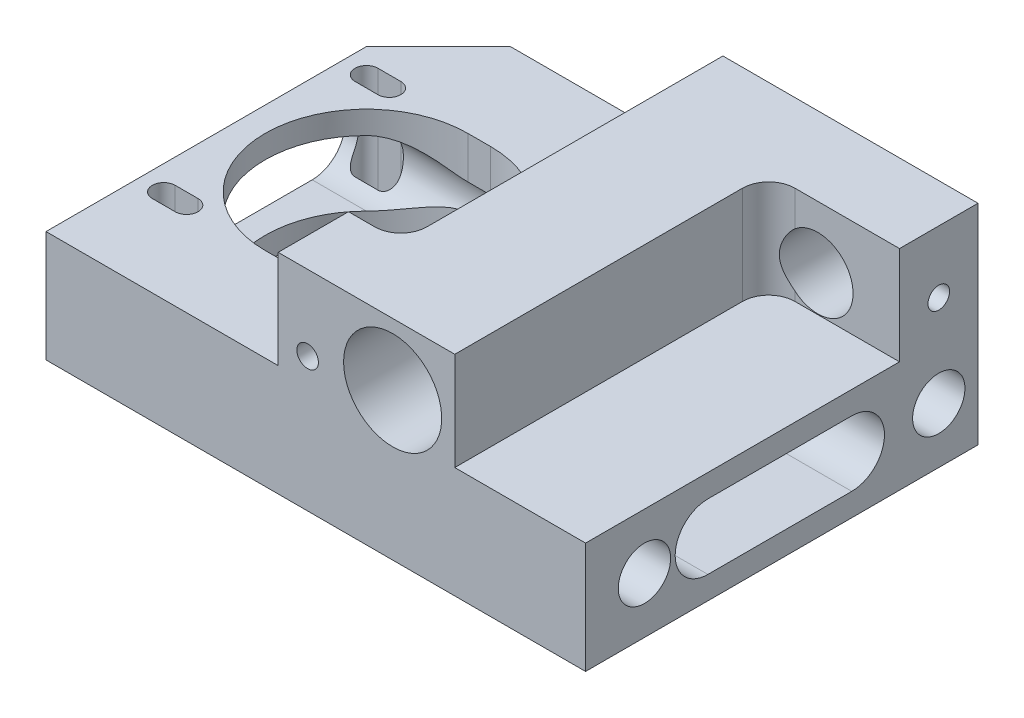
SolidWorks part; units mm, degrees
ref_plane "Plan de face" through (0, 0, 0) normal (0, 0, 1) x (1, 0, 0)
ref_plane "Plan de dessus" through (0, 0, 0) normal (0, 1, 0) x (1, 0, 0)
ref_plane "Plan de droite" through (0, 0, 0) normal (1, 0, 0) x (0, 0, -1)
sketch "Esquisse1" plane through (0, 0, 0) normal (0, 1, 0) x (1, 0, 0)
  line L0 (0, 0) -> (0, 49)
  line L1 (0, 49) -> (11, 60)
  line L2 (11, 60) -> (82.5, 60)
  line L3 (82.5, 60) -> (82.5, 0)
  line L4 (82.5, 0) -> (0, 0)
  line L5 (34.75, 47) -> (38.25, 47)
  line L6 (3.75, 47) -> (7.25, 47)
  line L7 (34.75, 43.5) -> (38.25, 43.5)
  line L8 (3.75, 43.5) -> (7.25, 43.5)
  line L9 (34.75, 16) -> (38.25, 16)
  line L10 (34.75, 12.5) -> (38.25, 12.5)
  line L11 (3.75, 16) -> (7.25, 16)
  line L12 (3.75, 12.5) -> (7.25, 12.5)
  line L13 (19.25, 29.75) -> (22.75, 29.75) construction
  line L14 (19.25, 45.25) -> (22.75, 45.25)
  line L15 (19.25, 14.25) -> (22.75, 14.25)
  arc A0 (7.25, 47) -> (7.25, 43.5) centre (7.25, 45.25) cw
  arc A1 (3.75, 47) -> (3.75, 43.5) centre (3.75, 45.25) ccw
  arc A2 (34.75, 47) -> (34.75, 43.5) centre (34.75, 45.25) ccw
  arc A3 (38.25, 47) -> (38.25, 43.5) centre (38.25, 45.25) cw
  arc A4 (34.75, 16) -> (34.75, 12.5) centre (34.75, 14.25) ccw
  arc A5 (38.25, 16) -> (38.25, 12.5) centre (38.25, 14.25) cw
  arc A6 (3.75, 16) -> (3.75, 12.5) centre (3.75, 14.25) ccw
  arc A7 (7.25, 16) -> (7.25, 12.5) centre (7.25, 14.25) cw
  arc A8 (19.25, 45.25) -> (19.25, 14.25) centre (19.25, 29.75) ccw
  arc A9 (22.75, 14.25) -> (22.75, 45.25) centre (22.75, 29.75) ccw
  point P32 (21, 29.75)
  dimension "D7" = 1.75
  dimension "D11" = 15.5
  dimension "D1" = 82.5
  dimension "D2" = 60
  dimension "D3" = 11
  dimension "D4" = 11
  dimension "D5" = 16.5
  dimension "D6" = 3.75
  dimension "D10" = 3.5
  dimension "D12" = 21
  dimension "D13" = 3.5
  dimension "D14" = 30.25
  dimension "D15" = 31
  dimension "D16" = 31
  dimension "D8" = 2
  dimension "D9" = 2
extrude "Boss.-Extru.1" add sketch "Esquisse1" along normal blind 32
sketch "Esquisse2" plane through (0, 32, 0) normal (0, 1, 0) x (1, 0, 0)
  line L0 (0, 49) -> (11, 60)
  line L1 (11, 60) -> (43.5, 60)
  line L2 (82.5, 60) -> (11, 60) construction
  line L3 (43.5, 60) -> (43.5, 14.75)
  line L4 (39.5, 10.75) -> (35.5, 10.75)
  line L5 (35.5, 10.75) -> (35.5, 0)
  line L6 (0, 0) -> (82.5, 0) construction
  line L7 (35.5, 0) -> (0, 0)
  line L8 (0, 0) -> (0, 49)
  line L9 (66.5, 48) -> (82.5, 48)
  line L10 (82.5, 0) -> (82.5, 60) construction
  line L11 (82.5, 48) -> (82.5, 0)
  line L12 (82.5, 0) -> (62.5, 0)
  line L13 (62.5, 0) -> (62.5, 44)
  arc A0 (43.5, 14.75) -> (39.5, 10.75) centre (39.5, 14.75) cw
  arc A1 (66.5, 48) -> (62.5, 44) centre (66.5, 44) ccw
  dimension "D6" = 4
  dimension "D1" = 10.75
  dimension "D2" = 19
  dimension "D3" = 12
  dimension "D4" = 20
  dimension "D5" = 27
extrude "Enlèv. mat.-Extru.1" cut sketch "Esquisse2" against normal blind 15
sketch "Esquisse3" plane through (0, 0, -60) normal (0, 0, -1) x (-1, 0, 0)
  line L0 (-82.5, 0) -> (-11, 0) construction
  line L1 (-82.5, 32) -> (-82.5, 0) construction
  circle A0 centre (-53, 22.5) radius 7.5
  dimension "D3" = 15
  dimension "D1" = 22.5
  dimension "D2" = 29.5
extrude "Enlèv. mat.-Extru.2" cut sketch "Esquisse3" against normal through all
hole_wizard "Trou taraudé M12x1.251" positions "Esquisse5" profile "Esquisse4" tap size "M12x1.25" standard "ISO"
sketch "Esquisse5" plane through (0, 0, -60) normal (0, 0, -1) x (-1, 0, 0)
  line L0 (-82.5, 0) -> (-11, 0) construction
  line L1 (-82.5, 32) -> (-82.5, 0) construction
  point P0 (-70, 22.5)
  dimension "D1" = 22.5
  dimension "D2" = 12.5
sketch "Esquisse4" plane through (70, 22.5, -60) normal (1, 0, 0) x (0, 1, 0)
  line L0 (0, 0) -> (0, 60)
  line L1 (0, 60) -> (5.4, 60)
  line L2 (5.4, 60) -> (5.4, 0)
  line L5 (5.4, 0) -> (0, 0)
  line L11 (0, -6.35) -> (0, 107.95) construction
  dimension "Diamètre du trou pour taraudage jusqu'au prochain" = 10.8
  dimension "Profondeur du trou pour taraudage jusqu'au prochain" = 60
hole_wizard "Trou taraudé M41" positions "Esquisse7" profile "Esquisse6" tap size "M4" standard "ISO"
sketch "Esquisse7" plane through (0, 0, 0) normal (0, 0, 1) x (1, 0, 0)
  line L0 (82.5, 17) -> (82.5, 0) construction
  line L1 (0, 0) -> (82.5, 0) construction
  point P0 (40, 20.5)
  dimension "D1" = 42.5
  dimension "D2" = 20.5
sketch "Esquisse6" plane through (40, 20.5, 0) normal (1, 0, 0) x (0, -1, 0)
  line L0 (0, 0) -> (0, 60)
  line L1 (0, 60) -> (1.65, 60)
  line L2 (1.65, 60) -> (1.65, 0)
  line L5 (1.65, 0) -> (0, 0)
  line L11 (0, -6.35) -> (0, 107.95) construction
  dimension "Diamètre du trou pour taraudage jusqu'au prochain" = 3.3
  dimension "Profondeur du trou pour taraudage jusqu'au prochain" = 60
hole_wizard "Trous de centrage Ø8.0mm1" positions "Esquisse9" profile "Esquisse8" hole size "Ø8.0" standard "ISO"
sketch "Esquisse9" plane through (82.5, 0, 0) normal (1, 0, 0) x (0, 0, -1)
  line L0 (60, 32) -> (60, 0) construction
  line L1 (0, 0) -> (60, 0) construction
  point P0 (9, 8.5)
  point P2 (54, 8.5)
  dimension "D1" = 45
  dimension "D2" = 6
  dimension "D3" = 8.5
sketch "Esquisse8" plane through (82.5, 8.5, -9) normal (0, 1, 0) x (0, 0, -1)
  line L0 (0, 0) -> (0, 41.4034)
  line L1 (0, 41.4034) -> (4, 39)
  line L2 (4, 39) -> (4, 0)
  line L5 (4, 0) -> (0, 0)
  line L10 (0, 41.4034) -> (-4, 39) construction
  line L11 (0, -6.35) -> (0, 107.95) construction
  dimension "Diamètre du perçage" = 8
  dimension "Profondeur du perçage" = 39
  dimension "Angle de pointe" = 118
sketch "Esquisse10" plane through (82.5, 0, 0) normal (1, 0, 0) x (0, 0, -1)
  line L0 (18.7, 8.5) -> (40.7, 8.5) construction
  line L1 (18.7, 13.5) -> (40.7, 13.5)
  line L2 (18.7, 3.5) -> (40.7, 3.5)
  line L3 (60, 32) -> (60, 0) construction
  arc A0 (18.7, 13.5) -> (18.7, 3.5) centre (18.7, 8.5) ccw
  arc A1 (40.7, 3.5) -> (40.7, 13.5) centre (40.7, 8.5) ccw
  point P2 (29.7, 8.5)
  dimension "D2" = 5
  dimension "D1" = 22
  dimension "D3" = 19.3
  dimension "D4" = 8.5
extrude "Enlèv. mat.-Extru.3" cut sketch "Esquisse10" against normal through all
hole_wizard "Trou taraudé M42" positions "Esquisse12" profile "Esquisse11" tap size "M4" standard "ISO"
sketch "Esquisse12" plane through (82.5, 0, 0) normal (1, 0, 0) x (0, 0, -1)
  line L1 (60, 32) -> (60, 0) construction
  line L2 (0, 0) -> (60, 0) construction
  point P0 (54, 22.5)
  dimension "D1" = 6
  dimension "D2" = 22.5
sketch "Esquisse11" plane through (82.5, 22.5, -54) normal (0, 1, 0) x (0, 0, -1)
  line L0 (0, 0) -> (0, 10.9914)
  line L1 (0, 10.9914) -> (1.65, 10)
  line L2 (1.65, 10) -> (1.65, 0)
  line L5 (1.65, 0) -> (0, 0)
  line L10 (0, 10.9914) -> (-1.65, 10) construction
  line L11 (0, -6.35) -> (0, 107.95) construction
  dimension "Diamètre du trou pour taraudage" = 3.3
  dimension "Profondeur du trou pour taraudage" = 10
  dimension "Angle de pointe" = 118
